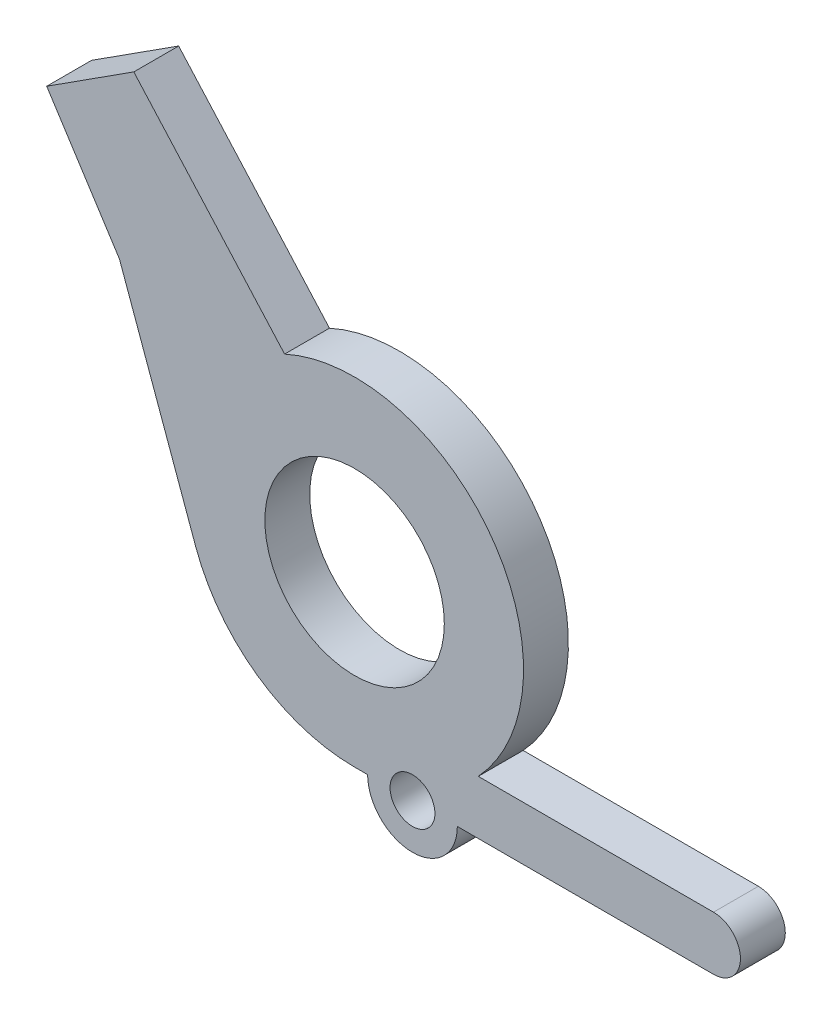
SolidWorks part; units mm, degrees
ref_plane "Plan1" through (0, 0, 0) normal (0, 0, 1) x (1, 0, 0)
ref_plane "Plan2" through (0, 0, 0) normal (0, 1, 0) x (1, 0, 0)
ref_plane "Plan3" through (0, 0, 0) normal (1, 0, 0) x (0, 0, -1)
sketch "Esquisse1" plane through (0, 0, 0) normal (0, 0, 1) x (1, 0, 0)
  line L0 (0, -3.7656) -> (8, -3.7656)
  line L1 (2.7563, -2.5656) -> (8, -2.5656)
  line L2 (-3.5413, -1.2801) -> (-5.2411, 3.4221)
  line L3 (-5.2411, 3.4221) -> (-6.8626, 5.9461)
  line L4 (-6.8626, 5.9461) -> (-4.9212, 7.1933)
  line L5 (-4.9212, 7.1933) -> (-1.56, 3.4273)
  circle A0 centre (0, 0) radius 2
  arc A1 (0, -3.7656) -> (-3.5413, -1.2801) centre (0, 0) cw
  arc A2 (8, -3.7656) -> (8, -2.5656) centre (8, -3.1656) ccw
  arc A3 (-1.56, 3.4273) -> (2.7563, -2.5656) centre (0, 0) cw
  dimension "D1" = 4
  dimension "D2" = 5
  dimension "D3" = 0.6
  dimension "D5" = 3
  dimension "D4" = 8
extrude "Base-Extrusion" add sketch "Esquisse1" along normal blind 1
sketch "Esquisse2" plane through (0, 0, 1) normal (0, 0, 1) x (1, 0, 0)
  line L0 (0, -3.7656) -> (8, -3.7656) construction
  circle A1 centre (1.2901, -3.7656) radius 1
  dimension "D2" = 2
extrude "Boss.-Extru.2" add sketch "Esquisse2" against normal blind 1
sketch "Esquisse3" plane through (0, 0, 1) normal (0, 0, 1) x (1, 0, 0)
  circle A0 centre (1.2901, -3.7656) radius 0.5
  dimension "D1" = 1
extrude "Enlèv. mat.-Extru.1" cut sketch "Esquisse3" against normal through all
